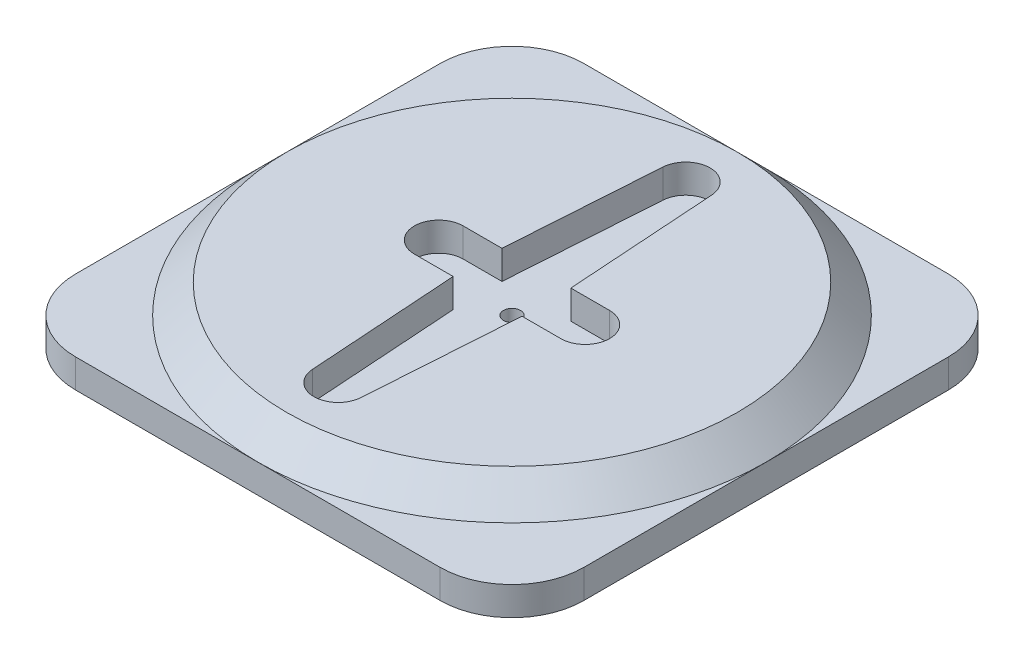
SolidWorks part; units mm, degrees
ref_plane "Front Plane" through (0, 0, 0) normal (0, 0, 1) x (1, 0, 0)
ref_plane "Top Plane" through (0, 0, 0) normal (0, 1, 0) x (1, 0, 0)
ref_plane "Right Plane" through (0, 0, 0) normal (1, 0, 0) x (0, 0, -1)
sketch "Sketch1" plane through (0, 0, 0) normal (0, 1, 0) x (1, 0, 0)
  line L0 (-22.479, -22.479) -> (22.479, 22.479) construction
  line L1 (-22.479, 22.479) -> (22.479, 22.479)
  line L2 (-22.479, 22.479) -> (-22.479, -22.479)
  line L3 (-22.479, -22.479) -> (22.479, -22.479)
  line L4 (22.479, 22.479) -> (22.479, -22.479)
  circle A0 centre (0, 0) radius 0.762
  point P4 (0, 0)
  dimension "D3" = 1.524
  dimension "D1" = 44.958
  dimension "D2" = 44.958
extrude "Boss-Extrude1" add sketch "Sketch1" along normal blind 2.54
fillet "Fillet1" radius 6.35 4 edges at (22.479, 1.27, -22.479) (-22.479, 1.27, -22.479) (-22.479, 1.27, 22.479) (22.479, 1.27, 22.479)
sketch "Sketch2" plane through (0, 2.54, 0) normal (0, 1, 0) x (1, 0, 0)
  circle A0 centre (0, 0) radius 22.479
  circle A1 centre (0, 0) radius 0.762 construction
  circle A2 centre (0, 0) radius 0.762
extrude "Boss-Extrude2" add sketch "Sketch2" along normal blind 2.54
chamfer "Chamfer1" distance 2.54 angle 45 1 edges at (0, 5.08, 22.479)
sketch "Sketch3" plane through (0, 5.08, 0) normal (0, 1, 0) x (1, 0, 0)
  line L0 (0, -15.367) -> (0, 15.367) construction
  line L1 (-6.477, 0) -> (6.477, 0) construction
  line L2 (-2.1542, -15.5108) -> (-3.0457, -2.159)
  line L3 (-6.477, -2.159) -> (-3.0457, -2.159)
  line L4 (6.477, -2.159) -> (3.0457, -2.159)
  line L5 (2.1542, -15.5108) -> (3.0457, -2.159)
  line L6 (-6.477, 2.159) -> (-3.0457, 2.159)
  line L7 (-2.1542, 15.5108) -> (-3.0457, 2.159)
  line L8 (6.477, 2.159) -> (3.0457, 2.159)
  line L9 (2.1542, 15.5108) -> (3.0457, 2.159)
  arc A1 (2.1542, 15.5108) -> (-2.1542, 15.5108) centre (0, 15.367) ccw
  arc A2 (-6.477, 2.159) -> (-6.477, -2.159) centre (-6.477, 0) ccw
  arc A3 (6.477, -2.159) -> (6.477, 2.159) centre (6.477, 0) ccw
  arc A4 (-2.1542, -15.5108) -> (2.1542, -15.5108) centre (0, -15.367) ccw
  point P0 (0, 0)
  point P3 (0, 0)
  dimension "D1" = 4.318
  dimension "D2" = 4.318
  dimension "D3" = 30.734
  dimension "D4" = 12.954
  dimension "D5" = 3.82
extrude "Cut-Extrude1" cut sketch "Sketch3" against normal blind 2.54
